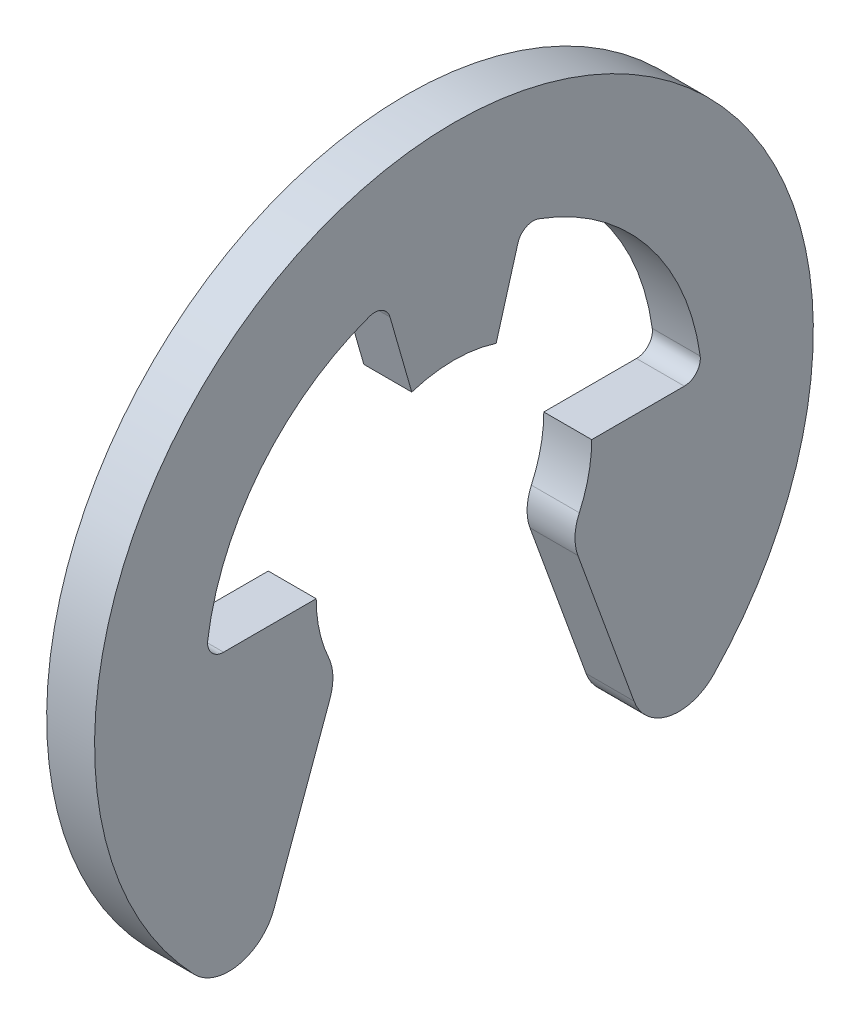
SolidWorks part; units mm, degrees
ref_plane "Plan1" through (0, 0, 0) normal (0, 0, 1) x (1, 0, 0)
ref_plane "Plan2" through (0, 0, 0) normal (0, 1, 0) x (1, 0, 0)
ref_plane "Plan3" through (0, 0, 0) normal (1, 0, 0) x (0, 0, -1)
sketch "Esquisse1" plane through (0, 0, 0) normal (1, 0, 0) x (0, 0, -1)
  line L0 (0, 0) -> (1.6991, -2.4725) construction
  line L1 (0, 0) -> (0, -9.1601) construction
  line L2 (-20, 0) -> (20, 0) construction
  line L3 (0, 0) -> (0.8269, 2.8838) construction
  line L4 (-20, 0.1333) -> (20, 0.1333) construction
  line L5 (0.3521, 1.2281) -> (1.6991, -2.4725) construction
  line L6 (0.3521, 1.2281) -> (0.5339, 1.862)
  line L7 (-1.15, 0.1333) -> (-1.9233, 0.1333)
  line L8 (1.0344, -0.6465) -> (1.503, -1.9339)
  line L9 (1.15, 0.1333) -> (1.9233, 0.1333)
  line L10 (-1.0344, -0.6465) -> (-1.503, -1.9339)
  line L11 (-0.3521, 1.2281) -> (-0.5339, 1.862)
  arc A0 (2.168, -2.0736) -> (-2.168, -2.0736) centre (0, 0) ccw
  arc A1 (2.0553, 0.285) -> (0.7076, 1.9506) centre (0, 0) ccw
  arc A2 (0.3521, 1.2281) -> (-0.3521, 1.2281) centre (0, 0.1333) ccw
  arc A3 (1.15, 0.1333) -> (1.0464, -0.3438) centre (0, 0.1333) cw
  arc A4 (2.168, -2.0736) -> (1.503, -1.9339) centre (1.8789, -1.7971) cw
  arc A5 (0.7076, 1.9506) -> (0.5339, 1.862) centre (0.6621, 1.8253) ccw
  arc A6 (2.0553, 0.285) -> (1.9233, 0.1333) centre (1.9233, 0.2667) cw
  arc A7 (-2.0553, 0.285) -> (-1.9233, 0.1333) centre (-1.9233, 0.2667) ccw
  arc A8 (-0.7076, 1.9506) -> (-0.5339, 1.862) centre (-0.6621, 1.8253) cw
  arc A9 (-2.168, -2.0736) -> (-1.503, -1.9339) centre (-1.8789, -1.7971) ccw
  arc A10 (-1.15, 0.1333) -> (-1.0464, -0.3438) centre (0, 0.1333) ccw
  arc A11 (-2.0553, 0.285) -> (-0.7076, 1.9506) centre (0, 0) cw
  arc A12 (1.0344, -0.6465) -> (1.0464, -0.3438) centre (1.4103, -0.5097) cw
  arc A13 (-1.0344, -0.6465) -> (-1.0464, -0.3438) centre (-1.4103, -0.5097) ccw
  point P24 (0.5719, 1.9946)
  dimension "D1" = 3
  dimension "D2" = 0.1333
  dimension "D3" = 2.075
  dimension "D4" = 0.4
  dimension "D7" = 0.4
  dimension "D8" = 16
  dimension "D9" = 20
extrude "Base-Extrusion" add sketch "Esquisse1" along normal blind 0.4
equation "\"D3@Esquisse1\" = (\"D1@Esquisse1\"+\"dn@Esquisse1\")/2"
equation "\"D4@Esquisse1\"=\"r@Esquisse1\"*2"
equation "\"r@Esquisse1\"=\"D1@Base-Extrusion\"/3"
equation "\"D2@Esquisse1\"=\"D1@Base-Extrusion\"/3"
